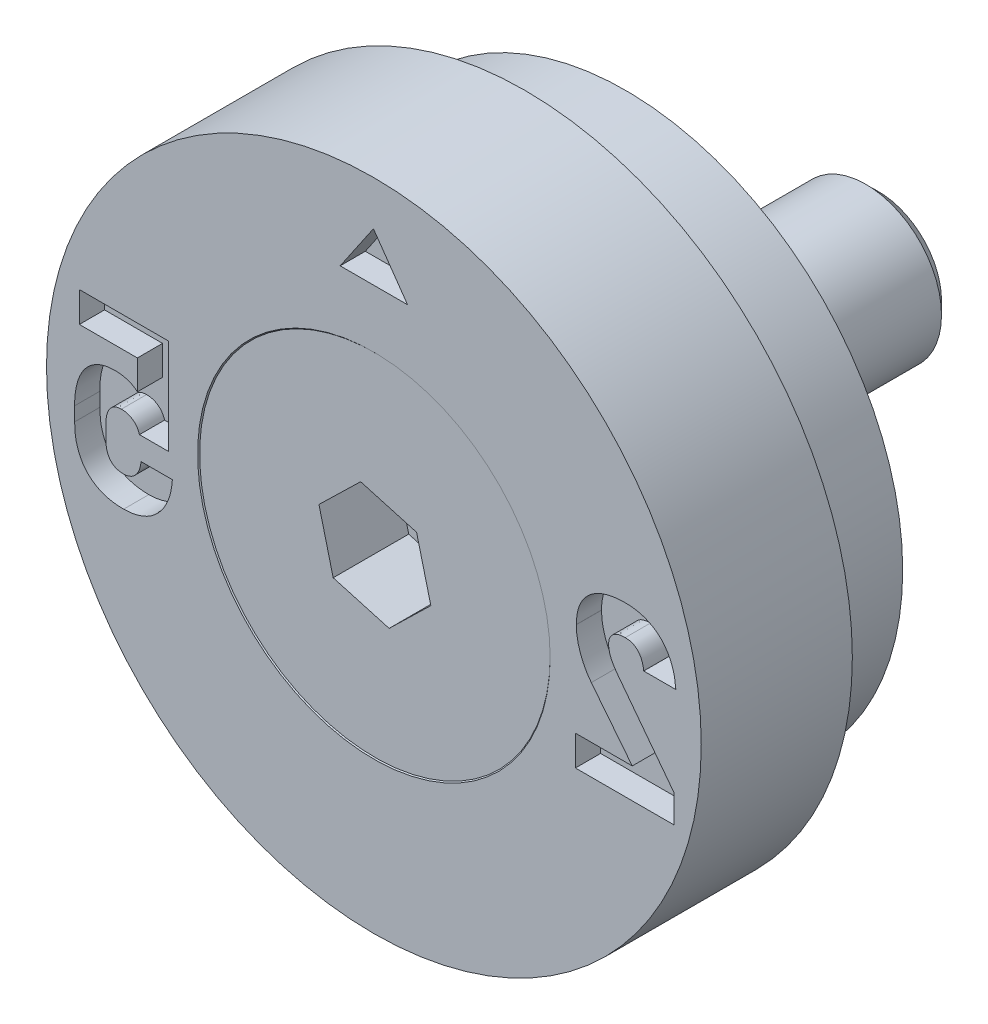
SolidWorks part; units mm, degrees
other "<M3 X .5 FHCS>-<Imported1>"
ref_plane "Front Plane" through (0, 0, 0) normal (0, 0, 1) x (1, 0, 0)
ref_plane "Top Plane" through (0, 0, 0) normal (0, 1, 0) x (1, 0, 0)
ref_plane "Right Plane" through (0, 0, 0) normal (1, 0, 0) x (0, 0, -1)
imported_body "Imported1"
sketch "Sketch1" plane through (0, 0, 0) normal (0, 0, 1) x (1, 0, 0)
  text T0 "2      5" font "Bahnschrift" height 3.302
  dimension "D1" = 1.651
  dimension "D2" = 6.2
extrude "Cut-Extrude1" cut sketch "Sketch1" against normal blind 0.5
inserted part "M3 X .5 FHCS"
move or copy body "Body-Move/Copy2" placed by mates yes
